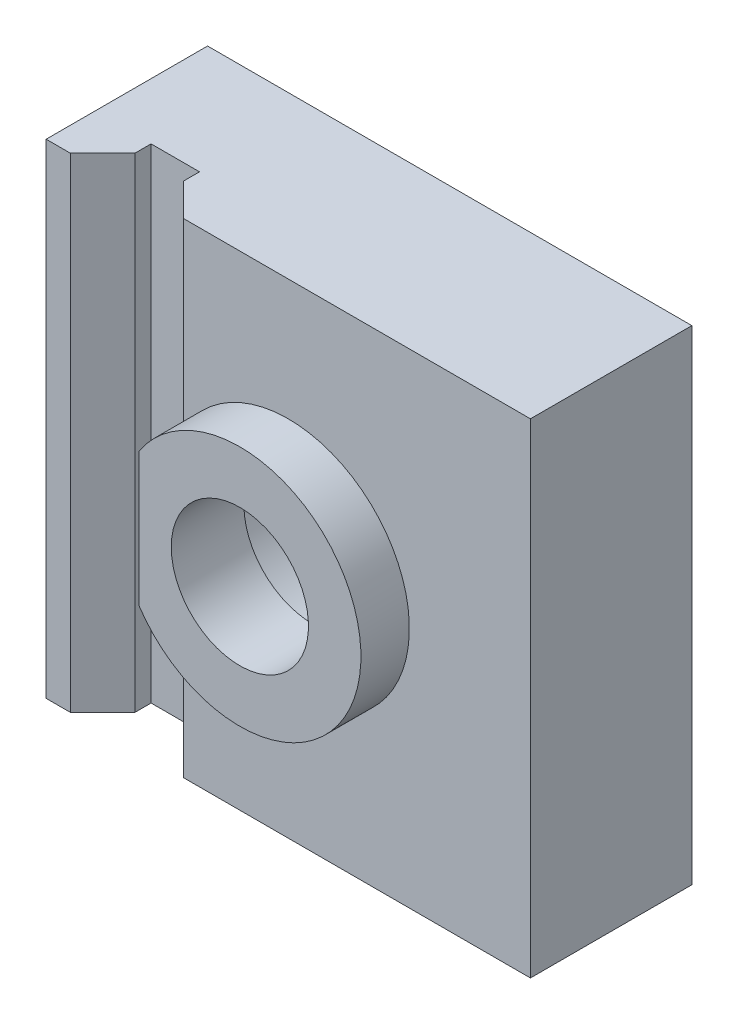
SolidWorks part; units mm, degrees
ref_plane "Ebene vorne" through (0, 0, 0) normal (0, 0, 1) x (1, 0, 0)
ref_plane "Ebene oben" through (0, 0, 0) normal (0, 1, 0) x (1, 0, 0)
ref_plane "Ebene rechts" through (0, 0, 0) normal (1, 0, 0) x (0, 0, -1)
sketch "Skizze1" plane through (0, 0, 0) normal (0, 0, 1) x (1, 0, 0)
  line L1 (-15, 15) -> (15, 15)
  line L2 (-15, 15) -> (-15, -15)
  line L3 (-15, -15) -> (15, -15)
  line L4 (15, 15) -> (15, -15)
  line L5 (-15, 15) -> (15, -15) construction
  line L6 (-15, -15) -> (15, 15) construction
  point P0 (0, 0)
  dimension "D1" = 30
  dimension "D2" = 30
extrude "Aufsatz-Linear austragen1" add sketch "Skizze1" along normal blind 10
sketch "Skizze2" plane through (0, 0, 10) normal (0, 0, 1) x (1, 0, 0)
  line L0 (-6.25, -4.1458) -> (-6.25, 4.1458)
  arc A0 (-6.25, -4.1458) -> (-6.25, 4.1458) centre (0, 0) ccw
  dimension "D1" = 6.25
extrude "Aufsatz-Linear austragen2" add sketch "Skizze2" along normal blind 3
hole_wizard "Stirnsenkung für M5 Zylinderschraube mit Innensechskant1" positions "Skizze5" profile "Skizze4" counterbore size "M5" standard "DIN"
sketch "Skizze5" plane through (0, 0, 0) normal (0, 0, -1) x (-1, 0, 0)
  point P0 (0, 0)
sketch "Skizze4" plane through (0, 0, 0) normal (1, 0, 0) x (0, 1, 0)
  line L0 (0, 0) -> (0, 13)
  line L1 (0, 13) -> (4.25, 13)
  line L3 (4.25, 13) -> (4.25, 8.5)
  line L4 (4.25, 8.5) -> (6.75, 8.5)
  line L5 (6.75, 8.5) -> (6.75, 0)
  line L7 (6.75, 0) -> (0, 0)
  line L11 (0, -6.35) -> (0, 107.95) construction
  dimension "Bohrerdurchmesser" = 8.5
  dimension "Bohrungstiefe" = 13
  dimension "Senkdurchmesser2" = 13.5
  dimension "Senktiefe2" = 8.5
sketch "Skizze6" plane through (0, 15, 0) normal (0, 1, 0) x (1, 0, 0)
  line L0 (-13.5, -10) -> (-11.5, -8)
  line L1 (15, -10) -> (-15, -10) construction
  line L2 (-11.5, -8) -> (-11.5, -7)
  line L3 (-11.5, -7) -> (-8.5, -7)
  line L4 (-8.5, -7) -> (-8.5, -8)
  line L5 (-8.5, -8) -> (-6.5, -10)
  line L6 (-6.5, -10) -> (-13.5, -10)
  line L7 (-10, -10) -> (-10, -1.9138) construction
  line L8 (0, 0) -> (0, -13) construction
  line L9 (-6.25, -13) -> (7.5, -13) construction
  dimension "D1" = 10
  dimension "D2" = 3
  dimension "D3" = 1
  dimension "D4" = 3
extrude "Schnitt-Linear austragen1" cut sketch "Skizze6" against normal through all
sketch "Skizze9" [suppressed] plane through (0, 0, 0) normal (0, 0, -1) x (-1, 0, 0)
  circle A0 centre (0, 0) radius 7.5
extrude "Aufsatz-Linear austragen3" [suppressed] add sketch "Skizze9" along normal blind 1.5
hole_wizard "Stirnsenkung für M5 Zylinderschraube mit Innensechskant2" positions "Skizze8" profile "Skizze7" counterbore size "M5" standard "DIN"
sketch "Skizze8" plane through (0, 0, 10) normal (0, 0, 1) x (1, 0, 0)
  point P0 (0, 0)
sketch "Skizze7" plane through (0, 0, 10) normal (1, 0, 0) x (0, -1, 0)
  line L0 (0, 0) -> (0, 11.5)
  line L1 (0, 11.5) -> (4.25, 11.5)
  line L3 (4.25, 11.5) -> (4.25, 3.5)
  line L4 (4.25, 3.5) -> (7.5, 3.5)
  line L5 (7.5, 3.5) -> (7.5, 0)
  line L7 (7.5, 0) -> (0, 0)
  line L11 (0, -6.35) -> (0, 107.95) construction
  dimension "Bohrerdurchmesser" = 8.5
  dimension "Bohrungstiefe" = 11.5
  dimension "Senkdurchmesser2" = 15
  dimension "Senktiefe2" = 3.5
sketch "Skizze10" [suppressed] plane through (0, -15, 0) normal (0, -1, 0) x (1, 0, 0)
  line L0 (0, -1.5) -> (0, 12.7253) construction
  line L1 (-7.5, -1.5) -> (7.5, -1.5) construction
  line L2 (-10, 11.2542) -> (-10, -0.4808) construction
  line L3 (-13.5, 10) -> (-11.5, 8)
  line L4 (-15, 10) -> (15, 10) construction
  line L5 (-11.5, 8) -> (-11.5, 7)
  line L6 (-13.5, 10) -> (-6.5, 10)
  line L7 (-11.5, 7) -> (-8.5, 7)
  line L8 (-8.5, 8) -> (-8.5, 7)
  line L9 (-6.5, 10) -> (-8.5, 8)
  point P15 (-10, 7)
  point P17 (-10, 10)
  dimension "D1" = 10
  dimension "D2" = 45
  dimension "D3" = 3
  dimension "D4" = 3
  dimension "D5" = 1
extrude "Schnitt-Linear austragen2" [suppressed] cut sketch "Skizze10" against normal through all
